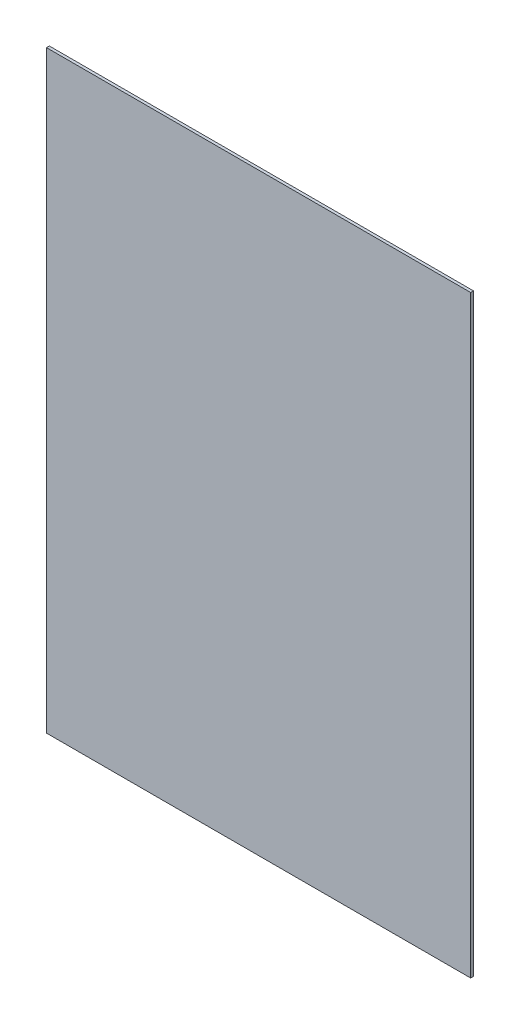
SolidWorks part; units mm, degrees
ref_plane "Plan de face" through (0, 0, 0) normal (0, 0, 1) x (1, 0, 0)
ref_plane "Plan de dessus" through (0, 0, 0) normal (0, 1, 0) x (1, 0, 0)
ref_plane "Plan de droite" through (0, 0, 0) normal (1, 0, 0) x (0, 0, -1)
sketch "Esquisse1" plane through (0, 0, 0) normal (0, 0, 1) x (1, 0, 0)
  line L1 (0, 0) -> (300, 0)
  line L2 (0, 0) -> (0, 420)
  line L3 (0, 420) -> (300, 420)
  line L4 (300, 0) -> (300, 420)
  dimension "D1" = 300
  dimension "D2" = 420
extrude "Boss.-Extru.1" add sketch "Esquisse1" along normal blind 2
